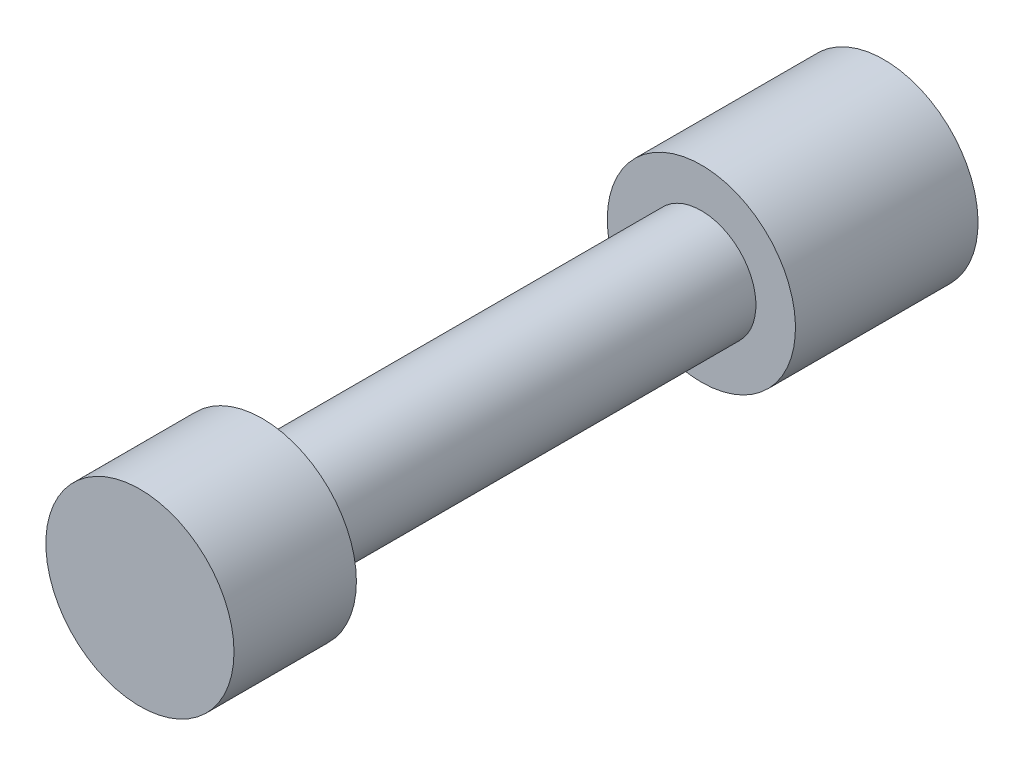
SolidWorks part; units mm, degrees
ref_plane "Front Plane" through (0, 0, 0) normal (0, 0, 1) x (1, 0, 0)
ref_plane "Top Plane" through (0, 0, 0) normal (0, 1, 0) x (1, 0, 0)
ref_plane "Right Plane" through (0, 0, 0) normal (1, 0, 0) x (0, 0, -1)
sketch "Sketch1" plane through (0, 0, 0) normal (0, 0, 1) x (1, 0, 0)
  circle A0 centre (0, 0) radius 14.2875
extrude "Boss-Extrude1" add sketch "Sketch1" against normal up to surface (18.5865 mm away)
sketch "Sketch2" plane through (0, 0, -18.5865) normal (0, 0, -1) x (-1, 0, 0)
  circle A0 centre (0, 0) radius 8.2804
  dimension "D1" = 16.5608
extrude "Boss-Extrude2" add sketch "Sketch2" along normal up to surface (94.9198 mm away)
ref_plane "Plane1" through (0, 0, -85.2614) normal (0, 0, -1) x (-1, 0, 0)
sketch "Sketch3" plane through (0, 0, -85.2614) normal (0, 0, -1) x (-1, 0, 0)
  circle A0 centre (0, 0) radius 14.2875
  arc A1 (-12.3733, -7.1437) -> (0, -14.2875) centre (0, 0) ccw construction
extrude "Boss-Extrude3" add sketch "Sketch3" along normal up to surface (27.7273 mm away)
